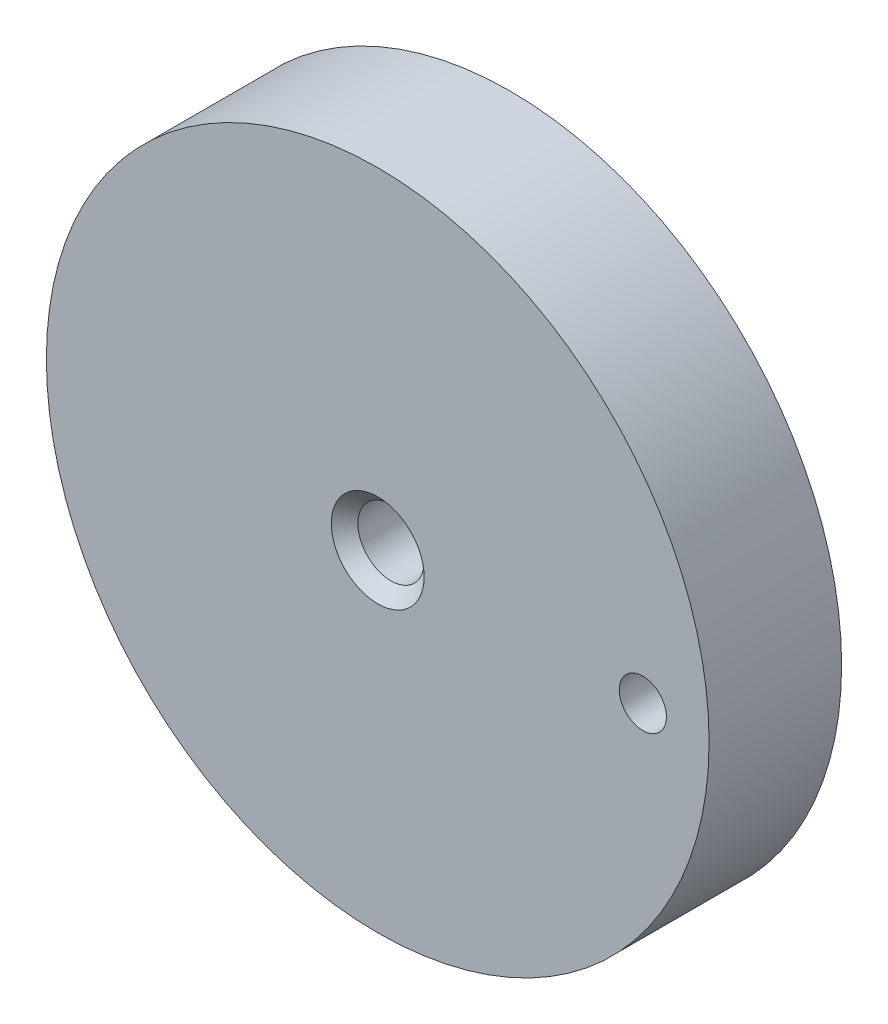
SolidWorks part; units mm, degrees
ref_plane "Front Plane" through (0, 0, 0) normal (0, 0, 1) x (1, 0, 0)
ref_plane "Top Plane" through (0, 0, 0) normal (0, 1, 0) x (1, 0, 0)
ref_plane "Right Plane" through (0, 0, 0) normal (1, 0, 0) x (0, 0, -1)
sketch "Sketch1" plane through (0, 0, 0) normal (0, 0, 1) x (1, 0, 0)
  circle A0 centre (0, 0) radius 6.35
  dimension "D1" = 12.7
extrude "Extrude1" add sketch "Sketch1" along normal blind 6.35
sketch "Sketch2" plane through (0, 0, 6.35) normal (0, 0, 1) x (1, 0, 0)
  circle A0 centre (0, 0) radius 15.875
  dimension "D1" = 31.75
extrude "Extrude2" add sketch "Sketch2" along normal blind 6.35
sketch "Sketch4" plane through (0, 0, 12.7) normal (0, 0, 1) x (1, 0, 0)
  circle A0 centre (0, 0) radius 12.7 construction
  dimension "D1" = 25.4
hole_wizard "#4-40 Tapped Hole1" positions "3DSketch2" profile "Sketch5" tap size "#4-40" standard "Ansi Inch"
sketch3d "3DSketch2"
  circle A0 centre (0, 0, 19.05) radius 12.7 construction
  point P0 (12.6956, -0.3351, 19.05)
  point P4 (0, 0, 31.75)
sketch "Sketch5" plane through (12.6956, -0.3351, 19.05) normal (1, 0, 0) x (0, -1, 0)
  line L0 (0, 0) -> (0, 19.05)
  line L1 (0, 19.05) -> (1.1303, 19.05)
  line L2 (1.1303, 19.05) -> (1.1303, 0)
  line L5 (1.1303, 0) -> (0, 0)
  line L11 (0, -6.35) -> (0, 107.95) construction
  dimension "Thru Tap Drill Dia." = 2.2606
  dimension "Thru Tap Drill Depth" = 19.05
sketch "Sketch8" plane through (0, 0, 0) normal (0, 0, -1) x (-1, 0, 0)
  circle A0 centre (0, 0) radius 1.5875
  dimension "D1" = 3.175
extrude "Extrude3" cut sketch "Sketch8" against normal blind 12.7
ref_plane "Plane1" through (0, -6.35, 3.175) normal (0, -1, 0) x (-1, 0, 0)
hole_wizard "#4-40 Tapped Hole2" positions "Sketch10" profile "Sketch9" tap size "#4-40" standard "Ansi Inch"
sketch "Sketch10" plane through (0, -6.35, 3.175) normal (0, -1, 0) x (-1, 0, 0)
  point P1 (0, -0.0275)
sketch "Sketch9" plane through (0, -6.35, 3.2025) normal (1, 0, 0) x (0, 0, -1)
  line L0 (0, 0) -> (0, 4.7625)
  line L1 (0, 4.7625) -> (1.1303, 4.7625)
  line L2 (1.1303, 4.7625) -> (1.1303, 0)
  line L5 (1.1303, 0) -> (0, 0)
  line L11 (0, -6.35) -> (0, 107.95) construction
  dimension "Thru Tap Drill Dia." = 2.2606
  dimension "Thru Tap Drill Depth" = 4.7625
sketch "Sketch11" plane through (0, 0, 12.7) normal (0, 0, 1) x (1, 0, 0)
  circle A0 centre (0, 0) radius 1.5875
  dimension "D1" = 3.175
extrude "Cut-Extrude1" [suppressed] cut sketch "Sketch11" against normal through all
chamfer "Chamfer1" distance 0.635 angle 45 1 edges at (-1.5875, 0, 12.7)
hole_wizard "#4-40 Tapped Hole3" positions "Sketch13" profile "Sketch12" tap size "#4-40" standard "Ansi Inch"
sketch "Sketch13" plane through (0, 0, 12.7) normal (0, 0, 1) x (1, 0, 0)
  line L0 (0, 0) -> (0, 50000) construction
  line L1 (0, 0) -> (50000, 0) construction
  point P0 (12.7, 0)
  dimension "D1" = 0
  dimension "D2" = 12.7
sketch "Sketch12" plane through (12.7, 0, 12.7) normal (1, 0, 0) x (0, -1, 0)
  line L0 (0, 0) -> (0, 19.7292)
  line L1 (0, 19.7292) -> (1.1303, 19.05)
  line L2 (1.1303, 19.05) -> (1.1303, 0)
  line L5 (1.1303, 0) -> (0, 0)
  line L10 (0, 19.7292) -> (-1.1303, 19.05) construction
  line L11 (0, -6.35) -> (0, 107.95) construction
  dimension "Tap Drill Dia." = 2.2606
  dimension "Tap Drill Depth" = 19.05
  dimension "Drill Angle" = 118
